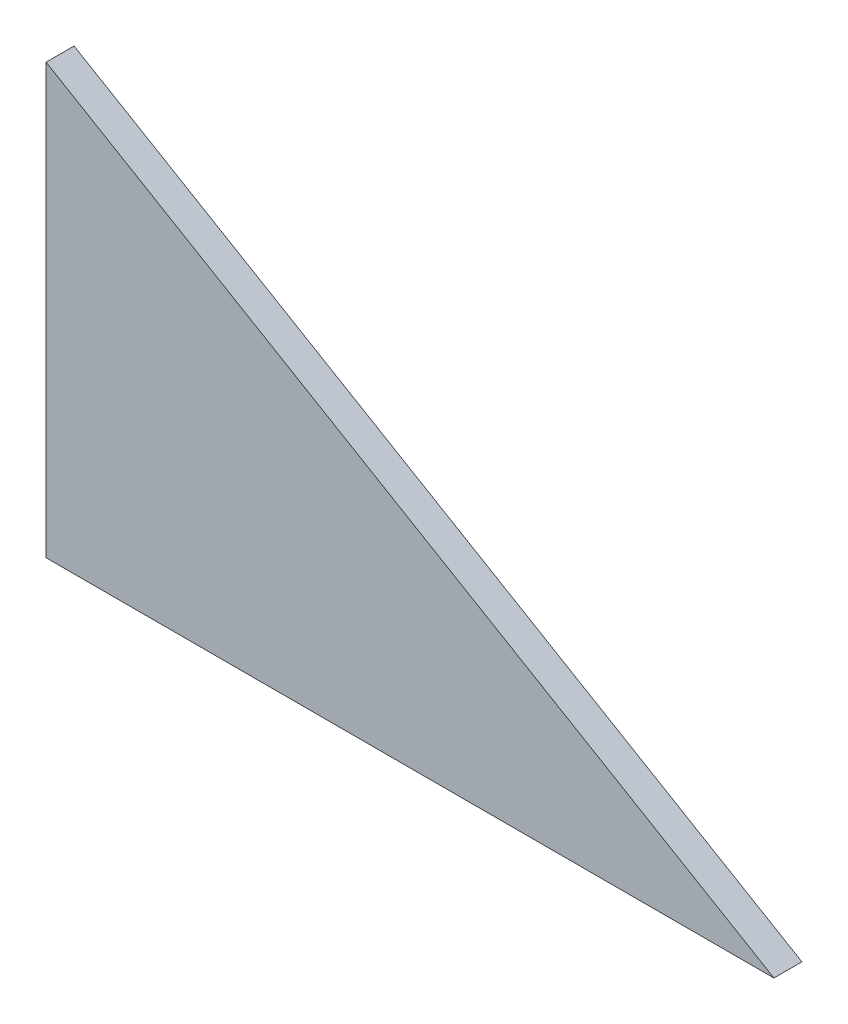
SolidWorks part; units mm, degrees
ref_plane "Front" through (0, 0, 0) normal (0, 0, 1) x (1, 0, 0)
ref_plane "Top" through (0, 0, 0) normal (0, 1, 0) x (1, 0, 0)
ref_plane "Right" through (0, 0, 0) normal (1, 0, 0) x (0, 0, -1)
sketch "Sketch1" plane through (0, 0, 0) normal (0, 0, 1) x (1, 0, 0)
  line L0 (0, 0) -> (0, 146.05)
  line L1 (0, 146.05) -> (247.65, 0)
  line L2 (247.65, 0) -> (0, 0)
  dimension "D1" = 146.05
  dimension "D2" = 247.65
extrude "Boss-Extrude1" add sketch "Sketch1" along normal blind 9.525
